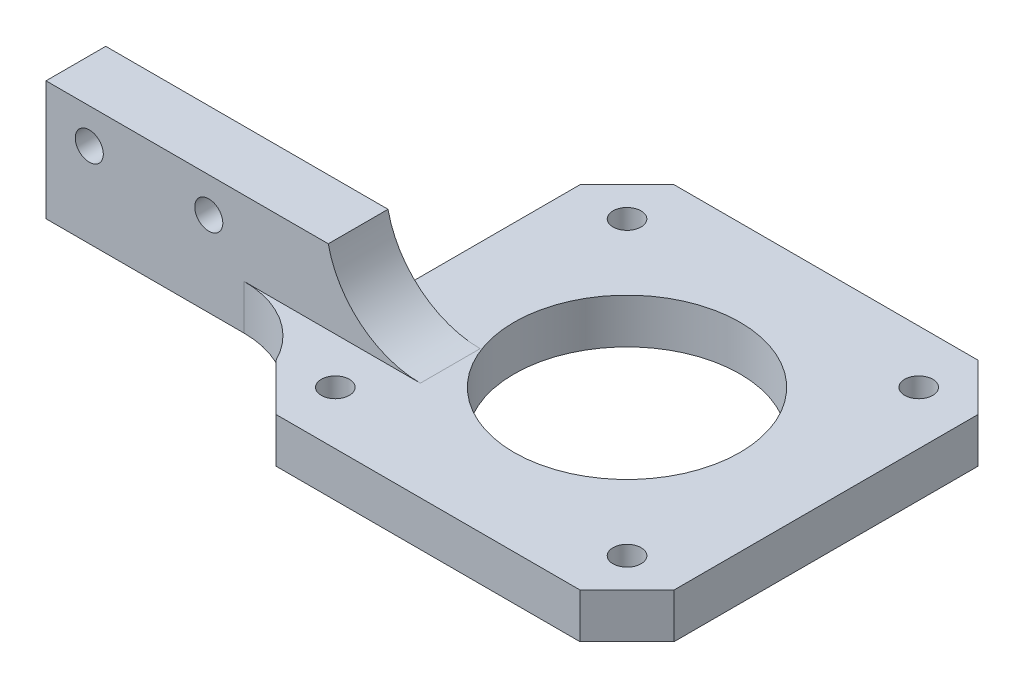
SolidWorks part; units mm, degrees
ref_plane "Front Plane" through (0, 0, 0) normal (0, 0, 1) x (1, 0, 0)
ref_plane "Top Plane" through (0, 0, 0) normal (0, 1, 0) x (1, 0, 0)
ref_plane "Right Plane" through (0, 0, 0) normal (1, 0, 0) x (0, 0, -1)
sketch "Sketch2" plane through (0, 0, 0) normal (0, 1, 0) x (1, 0, 0)
  line L0 (21.15, -16.15) -> (21.15, 16.15)
  line L1 (21.15, 16.15) -> (16.15, 21.15)
  line L2 (16.15, 21.15) -> (-16.15, 21.15)
  line L3 (-16.15, 21.15) -> (-21.15, 16.15)
  line L4 (-21.15, 16.15) -> (-21.15, -16.15)
  line L5 (-21.15, -16.15) -> (-16.15, -21.15)
  line L6 (-16.15, -21.15) -> (16.15, -21.15)
  line L7 (16.15, -21.15) -> (21.15, -16.15)
  circle A0 centre (-15.5, 15.5) radius 1.25 construction
  circle A1 centre (15.5, 15.5) radius 1.25 construction
  circle A2 centre (15.5, -15.5) radius 1.25 construction
  circle A3 centre (-15.5, -15.5) radius 1.25 construction
  circle A4 centre (0, 0) radius 11 construction
  circle A5 centre (0, 0) radius 12
  circle A6 centre (-15.5, 15.5) radius 1.49
  circle A7 centre (15.5, 15.5) radius 1.49
  circle A8 centre (15.5, -15.5) radius 1.49
  circle A9 centre (-15.5, -15.5) radius 1.49
  dimension "D2" = 24
  dimension "D1" = 2.98
extrude "Boss-Extrude2" add sketch "Sketch2" along normal blind 4.7625
sketch "Sketch3" plane through (-21.15, 0, 0) normal (-1, 0, 0) x (0, 0, 1)
  line L0 (-16.15, 0) -> (16.15, 0) construction
  line L1 (4.25, 0) -> (10.6, 0)
  line L2 (4.25, 0) -> (4.25, 12.7)
  line L3 (4.25, 12.7) -> (10.6, 12.7)
  line L4 (10.6, 0) -> (10.6, 12.7)
  line L5 (4.25, -0.525) -> (4.25, 19.525) construction
  dimension "D1" = 6.35
  dimension "D2" = 12.7
extrude "Boss-Extrude3" add sketch "Sketch3" along normal blind 30
fillet "Fillet1" radius 10 1 edges at (-21.15, 2.3813, 10.6)
fillet "Fillet2" radius 10 1 edges at (-21.15, 4.7625, 7.425)
sketch "Sketch4" plane through (0, 0, 4.25) normal (0, 0, -1) x (-1, 0, 0)
sketch "Sketch5" plane through (0, 0, 4.25) normal (0, 0, -1) x (-1, 0, 0)
  circle A0 centre (33.85, 9) radius 1.49
  circle A1 centre (46.55, 9) radius 1.49
  dimension "D1" = 2.98
extrude "Cut-Extrude2" cut sketch "Sketch5" against normal through all both and the other way through all
